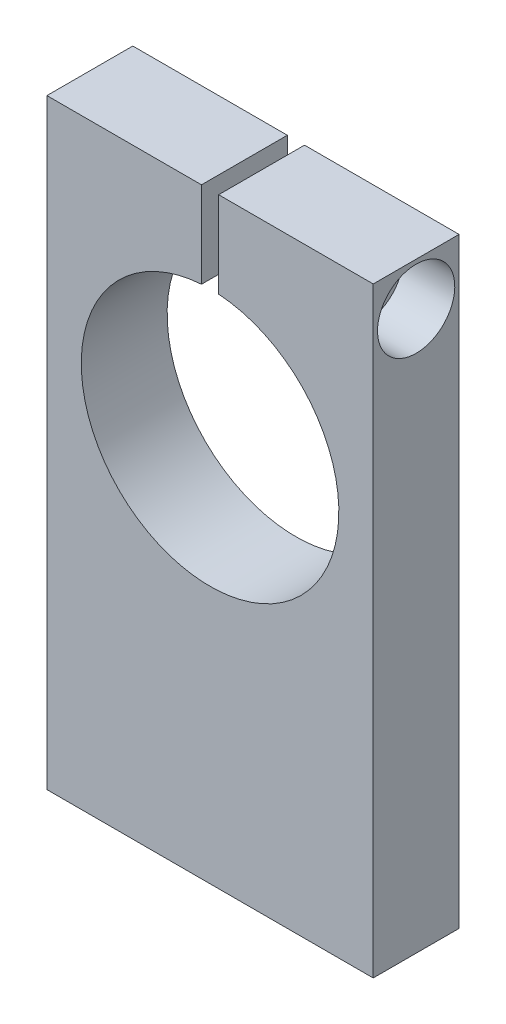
SolidWorks part; units mm, degrees
ref_plane "Plan de face" through (0, 0, 0) normal (0, 0, 1) x (1, 0, 0)
ref_plane "Plan de dessus" through (0, 0, 0) normal (0, 1, 0) x (1, 0, 0)
ref_plane "Plan de droite" through (0, 0, 0) normal (1, 0, 0) x (0, 0, -1)
sketch "Esquisse1" plane through (0, 0, 0) normal (0, 0, 1) x (1, 0, 0)
  line L0 (1, 25) -> (19, 25)
  line L1 (-19, 25) -> (-1, 25)
  line L2 (-19, 25) -> (-19, -45)
  line L3 (-19, -45) -> (19, -45)
  line L4 (19, 25) -> (19, -45)
  line L6 (-1, 25) -> (-1, 14.9666)
  line L8 (1, 25) -> (1, 14.9666)
  arc A0 (-1, 14.9666) -> (1, 14.9666) centre (0, 0) ccw
  dimension "D1" = 30
  dimension "D7" = 45
  dimension "D2" = 38
  dimension "D3" = 1
  dimension "D4" = 1
  dimension "D5" = 19
  dimension "D6" = 25
extrude "Extrusion1" add sketch "Esquisse1" along normal blind 10
hole_wizard "Trou taraudé M51" positions "Esquisse3" profile "Esquisse2" tap size "M5" standard "ISO"
sketch "Esquisse3" plane through (-1, 0, 0) normal (1, 0, 0) x (0, 0, -1)
  line L0 (0, -45) -> (0, 25) construction
  line L1 (-10, 25) -> (0, 25) construction
  point P0 (-5, 20)
  dimension "D1" = 5
  dimension "D2" = 5
sketch "Esquisse2" plane through (-1, 20, 5) normal (0, 1, 0) x (0, 0, -1)
  line L0 (0, 0) -> (0, 18)
  line L1 (0, 18) -> (2.1, 18)
  line L2 (2.1, 18) -> (2.1, 0)
  line L5 (2.1, 0) -> (0, 0)
  line L11 (0, -6.35) -> (0, 107.95) construction
  dimension "Diamètre du trou pour taraudage jusqu'au prochain" = 4.2
  dimension "Profondeur du trou pour taraudage jusqu'au prochain" = 18
sketch "Esquisse6" plane through (19, 0, 0) normal (1, 0, 0) x (0, 0, -1)
  circle A0 centre (-5, 20) radius 4.5
  dimension "D1" = 9
extrude "Enlèv. mat.-Extru.1" cut sketch "Esquisse6" against normal blind 6
sketch "Esquisse7" plane through (13, 0, 0) normal (1, 0, 0) x (0, 0, -1)
  circle A0 centre (-5, 20) radius 2.75
  dimension "D1" = 5.5
extrude "Enlèv. mat.-Extru.2" cut sketch "Esquisse7" against normal blind 12
hole_wizard "Trou taraudé M52" positions "Esquisse9" profile "Esquisse8" tap size "M5" standard "ISO"
sketch "Esquisse9" plane through (0, -45, 0) normal (0, -1, 0) x (1, 0, 0)
  line L0 (-19, 0) -> (19, 0) construction
  point P0 (-13, 5)
  point P1 (13, 5)
  dimension "D1" = 26
  dimension "D2" = 13
  dimension "D3" = 5
  dimension "D4" = 5
sketch "Esquisse8" plane through (-13, -45, 5) normal (1, 0, 0) x (0, 0, -1)
  line L0 (0, 0) -> (0, 20.2618)
  line L1 (0, 20.2618) -> (2.1, 19)
  line L2 (2.1, 19) -> (2.1, 0)
  line L5 (2.1, 0) -> (0, 0)
  line L10 (0, 20.2618) -> (-2.1, 19) construction
  line L11 (0, -6.35) -> (0, 107.95) construction
  dimension "Diamètre du trou pour taraudage" = 4.2
  dimension "Profondeur du trou pour taraudage" = 19
  dimension "Angle de pointe" = 118
